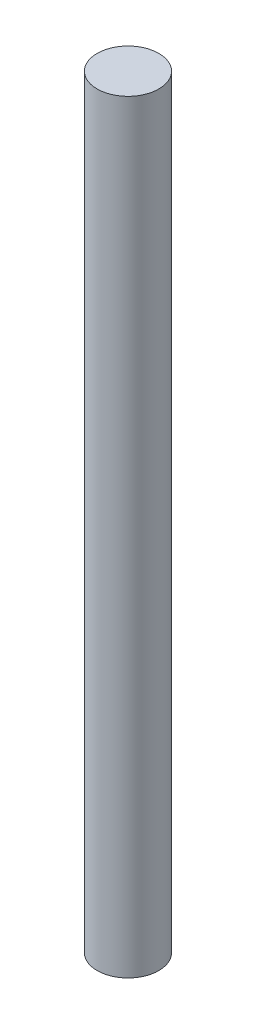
SolidWorks part; units mm, degrees
ref_plane "Front/Back" through (0, 0, 0) normal (0, 0, 1) x (1, 0, 0)
ref_plane "Top/Bottom" through (0, 0, 0) normal (0, 1, 0) x (1, 0, 0)
ref_plane "Right/Left" through (0, 0, 0) normal (1, 0, 0) x (0, 0, -1)
sketch "Sketch1" plane through (0, 0, 0) normal (0, 1, 0) x (1, 0, 0)
  circle A0 centre (0, 0) radius 13.335
  dimension "D1" = 26.67
extrude "Extrude1" add sketch "Sketch1" along normal blind 330.2
